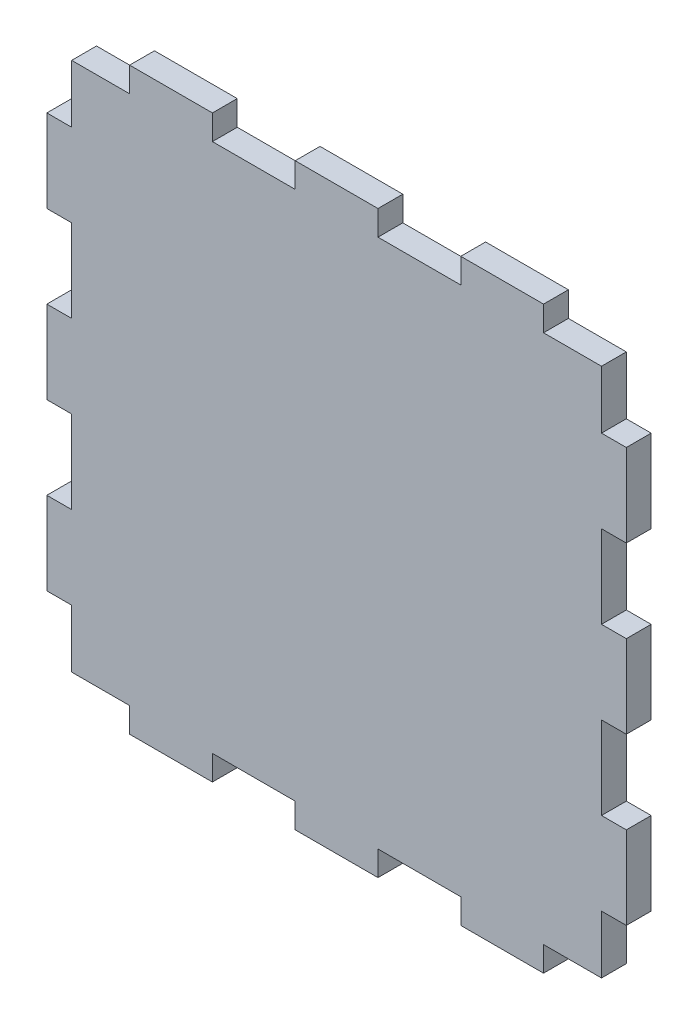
SolidWorks part; units mm, degrees
ref_plane "Front Plane" through (0, 0, 0) normal (0, 0, 1) x (1, 0, 0)
ref_plane "Top Plane" through (0, 0, 0) normal (0, 1, 0) x (1, 0, 0)
ref_plane "Right Plane" through (0, 0, 0) normal (1, 0, 0) x (0, 0, -1)
sketch "Sketch1" plane through (0, 0, 0) normal (0, 0, 1) x (1, 0, 0)
  line L1 (0, 0) -> (70, 0)
  line L2 (0, 0) -> (0, -70)
  line L3 (0, -70) -> (70, -70)
  line L4 (70, 0) -> (70, -70)
  line L5 (0, 0) -> (70, -70) construction
  line L6 (0, -70) -> (70, 0) construction
  point P4 (35, -35)
extrude "Boss-Extrude2" add sketch "Sketch1" along normal blind 3
sketch "Sketch3" plane through (0, 0, 3) normal (0, 0, 1) x (1, 0, 0)
  line L0 (20, -3) -> (30, -3)
  line L1 (0, 0) -> (10, 0)
  line L2 (0, 0) -> (0, -3)
  line L3 (0, -3) -> (10, -3)
  line L4 (10, 0) -> (10, -3)
  line L5 (0, 0) -> (10, -3) construction
  line L6 (0, -3) -> (10, 0) construction
  line L7 (20, 0) -> (20, -3)
  line L8 (20, 0) -> (30, 0)
  line L9 (30, 0) -> (30, -3)
  line L10 (40, -3) -> (50, -3)
  line L11 (40, 0) -> (40, -3)
  line L12 (40, 0) -> (50, 0)
  line L13 (50, 0) -> (50, -3)
  line L14 (60, -3) -> (70, -3)
  line L15 (60, 0) -> (60, -3)
  line L16 (60, 0) -> (70, 0)
  line L17 (70, 0) -> (70, -3)
  line L18 (0, -3) -> (20, -3) construction
  point P4 (5, -1.5)
  point P6 (10, -1.5)
extrude "Cut-Extrude3" cut sketch "Sketch3" against normal blind 33
sketch "Sketch4" plane through (0, 0, 3) normal (0, 0, 1) x (1, 0, 0)
  line L0 (30, -70) -> (30, -67)
  line L1 (0, -70) -> (10, -70)
  line L2 (0, -70) -> (0, -67)
  line L3 (0, -67) -> (10, -67)
  line L4 (10, -70) -> (10, -67)
  line L5 (0, -70) -> (10, -67) construction
  line L6 (0, -67) -> (10, -70) construction
  line L7 (20, -67) -> (30, -67)
  line L8 (20, -70) -> (30, -70)
  line L9 (20, -70) -> (20, -67)
  line L10 (50, -70) -> (50, -67)
  line L11 (40, -67) -> (50, -67)
  line L12 (40, -70) -> (50, -70)
  line L13 (40, -70) -> (40, -67)
  line L14 (70, -70) -> (70, -67)
  line L15 (60, -67) -> (70, -67)
  line L16 (60, -70) -> (70, -70)
  line L17 (60, -70) -> (60, -67)
  line L18 (10, -70) -> (30, -70) construction
  point P4 (5, -68.5)
extrude "Cut-Extrude4" cut sketch "Sketch4" against normal blind 33
sketch "Sketch5" plane through (0, 0, 3) normal (0, 0, 1) x (1, 0, 0)
  line L0 (20, 0) -> (10, 0) construction
  line L1 (0, 0) -> (3, 0)
  line L2 (0, 0) -> (0, -10)
  line L3 (0, -10) -> (3, -10)
  line L4 (3, 0) -> (3, -10)
  line L5 (0, 0) -> (3, -10) construction
  line L6 (0, -10) -> (3, 0) construction
  line L8 (0, -30) -> (3, -30)
  line L9 (3, -20) -> (3, -30)
  line L10 (0, -20) -> (3, -20)
  line L11 (0, -20) -> (0, -30)
  line L12 (0, -50) -> (3, -50)
  line L13 (3, -40) -> (3, -50)
  line L14 (0, -40) -> (3, -40)
  line L15 (0, -40) -> (0, -50)
  line L16 (0, -70) -> (3, -70)
  line L17 (3, -60) -> (3, -70)
  line L18 (0, -60) -> (3, -60)
  line L19 (0, -60) -> (0, -70)
  line L20 (0, -10) -> (0, -30) construction
  point P4 (1.5, -5)
extrude "Cut-Extrude5" cut sketch "Sketch5" against normal blind 33
sketch "Sketch6" plane through (0, 0, 3) normal (0, 0, 1) x (1, 0, 0)
  line L0 (67, -20) -> (67, -30)
  line L1 (70, 0) -> (67, 0)
  line L2 (70, 0) -> (70, -10)
  line L3 (70, -10) -> (67, -10)
  line L4 (67, 0) -> (67, -10)
  line L5 (70, 0) -> (67, -10) construction
  line L6 (70, -10) -> (67, 0) construction
  line L7 (70, -30) -> (67, -30)
  line L8 (70, -20) -> (70, -30)
  line L9 (70, -20) -> (67, -20)
  line L10 (67, -40) -> (67, -50)
  line L11 (70, -50) -> (67, -50)
  line L12 (70, -40) -> (70, -50)
  line L13 (70, -40) -> (67, -40)
  line L14 (67, -60) -> (67, -70)
  line L15 (70, -70) -> (67, -70)
  line L16 (70, -60) -> (70, -70)
  line L17 (70, -60) -> (67, -60)
  line L18 (67, 0) -> (67, -20) construction
  point P4 (68.5, -5)
extrude "Cut-Extrude6" cut sketch "Sketch6" against normal blind 33
equation "\"lenth\" = 70mm"
equation "\"width\"= \"lenth\""
equation "\"height\"= 3mm"
equation "\"finger_l\"= 10"
equation "\"finger_w\"= \"height\""
equation "\"D1@Sketch1\"=\"lenth\""
equation "\"D2@Sketch1\"=\"width\""
equation "\"D1@Boss-Extrude2\"=\"height\""
equation "\"D1@Sketch3\"=\"finger_l\""
equation "\"D1@Sketch4\"=\"finger_l\""
equation "\"D2@Sketch4\"=\"finger_w\""
equation "\"D1@Sketch5\"=\"finger_l\""
equation "\"D2@Sketch5\"=\"finger_w\""
equation "\"D1@Sketch6\"=\"finger_w\""
equation "\"D2@Sketch6\"=\"finger_l\""
